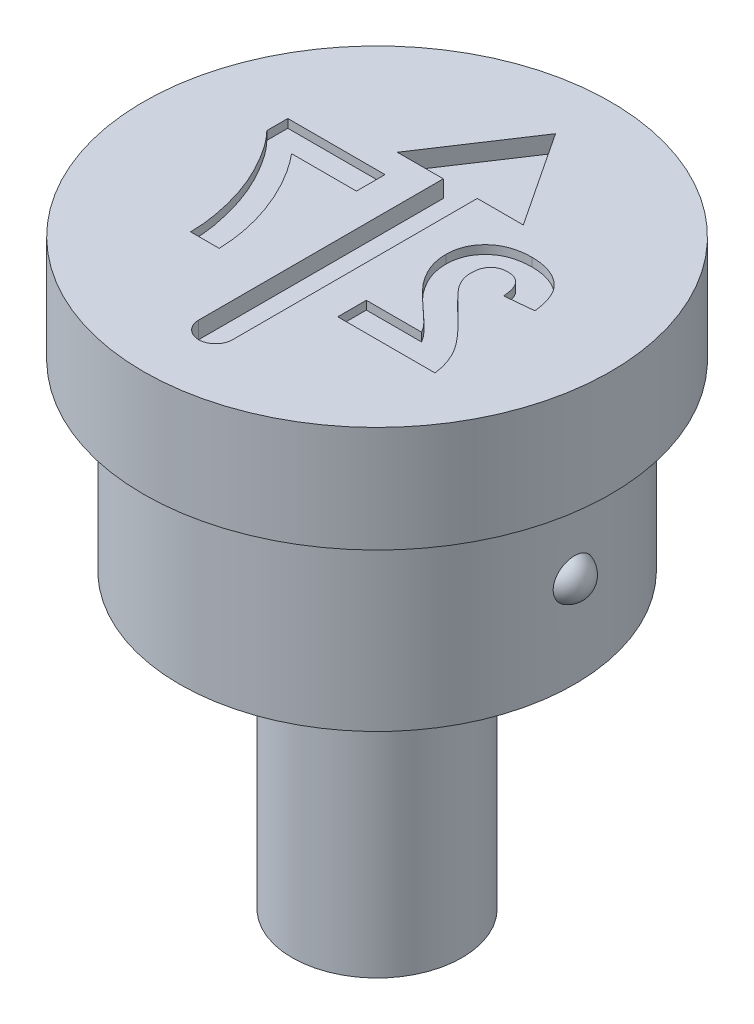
SolidWorks part; units mm, degrees
ref_plane "Front Plane" through (0, 0, 0) normal (0, 0, 1) x (1, 0, 0)
ref_plane "Top Plane" through (0, 0, 0) normal (0, 1, 0) x (1, 0, 0)
ref_plane "Right Plane" through (0, 0, 0) normal (1, 0, 0) x (0, 0, -1)
sketch "Sketch1" plane through (0, 0, 0) normal (0, 0, 1) x (1, 0, 0)
  line L0 (0, 0) -> (0, -13.7) construction
  line L1 (0, -6.05) -> (0, 6.05) construction
  line L2 (0, 0) -> (-5.5, 0)
  line L3 (-5.5, 0) -> (-5.5, -2.5)
  line L4 (-5.5, -2.5) -> (-4.65, -2.5)
  line L5 (-4.65, -2.5) -> (-4.65, -6.8)
  line L6 (-4.65, -6.8) -> (-2, -6.8)
  line L7 (-2, -6.8) -> (-2, -13.7)
  line L8 (-2, -13.7) -> (0, -13.7)
  line L9 (0, -13.7) -> (0, 0)
  dimension "D1" = 11
  dimension "D2" = 13.7
  dimension "D3" = 2.5
  dimension "D4" = 6.8
  dimension "D5" = 9.3
  dimension "D6" = 4
revolve "Revolve1" add sketch "Sketch1" angle 360 about L0
sketch "Sketch3" plane through (0, 0, 0) normal (0, 1, 0) x (1, 0, 0)
  line L0 (0, 4.2) -> (-1.4826, 1.96)
  line L1 (-1.4826, 1.96) -> (-0.4, 1.96)
  line L2 (-0.4, 1.96) -> (-0.4, -3.8)
  line L3 (0.4, -3.8) -> (0.4, 1.96)
  line L4 (0.4, 1.96) -> (1.4826, 1.96)
  line L5 (1.4826, 1.96) -> (0, 4.2)
  line L6 (0, 4.2) -> (0, -4.2) construction
  arc A0 (-0.4, -3.8) -> (0.4, -3.8) centre (0, -3.8) ccw
  dimension "D3" = 0.4
  dimension "D1" = 2.24
  dimension "D2" = 67
  dimension "D4" = 8
extrude "Cut-Extrude1" cut sketch "Sketch3" against normal blind 0.4
sketch "Sketch4" plane through (0, 0, 0) normal (0, 1, 0) x (1, 0, 0)
  text T0 "27" font "Arial" height 3.5
extrude "Cut-Extrude2" cut sketch "Sketch4" against normal blind 0.2
sketch "Sketch5" plane through (0, 0, 0) normal (0, 0, 1) x (1, 0, 0)
  line L2 (4.4833, -4.15) -> (4.4833, -5.15)
  line L3 (4.4833, -4.15) -> (4.4833, -5.15) construction
  line L4 (-4.65, -4.65) -> (4.4833, -4.65) construction
  line L5 (-4.65, -2.5) -> (-4.65, -6.8) construction
  arc A1 (4.4833, -5.15) -> (4.4833, -4.15) centre (4.4833, -4.65) ccw
  dimension "D1" = 0.5
revolve "Revolve2" add sketch "Sketch5" angle 360 about L2
